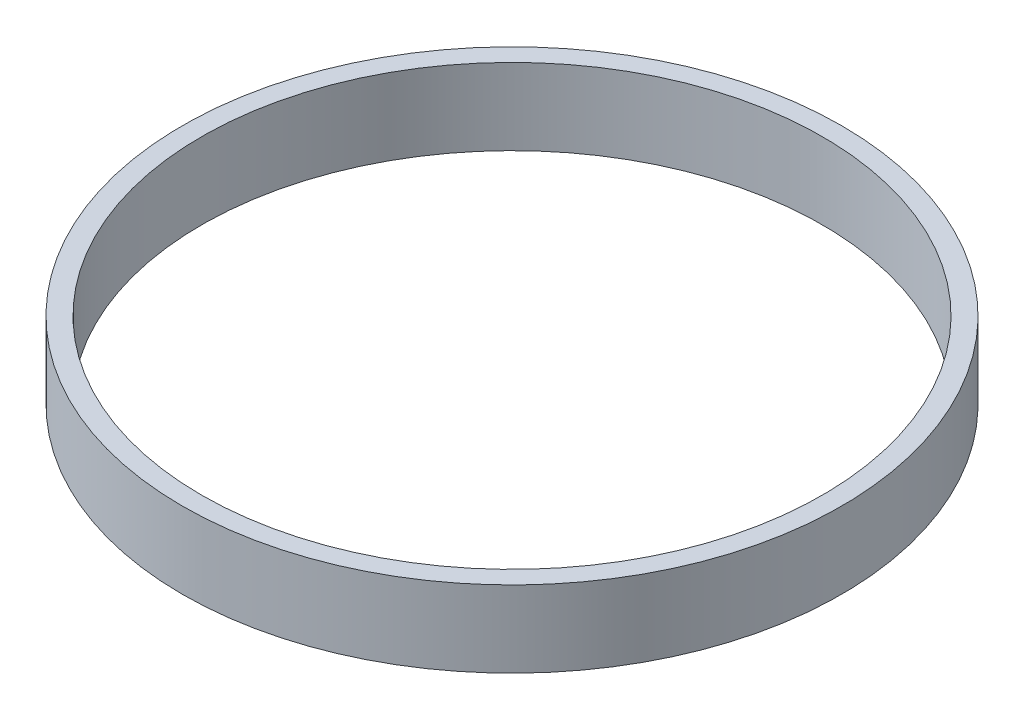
SolidWorks part; units mm, degrees
ref_plane "Front Plane" through (0, 0, 0) normal (0, 0, 1) x (1, 0, 0)
ref_plane "Top Plane" through (0, 0, 0) normal (0, 1, 0) x (1, 0, 0)
ref_plane "Right Plane" through (0, 0, 0) normal (1, 0, 0) x (0, 0, -1)
sketch "Sketch1" plane through (0, 0, 0) normal (0, 1, 0) x (1, 0, 0)
  circle A0 centre (0, 0) radius 109.5375
  circle A1 centre (0, 0) radius 103.1875
  dimension "D1" = 6.35
  dimension "D2" = 219.075
extrude "Boss-Extrude1" add sketch "Sketch1" along normal blind 25.4
